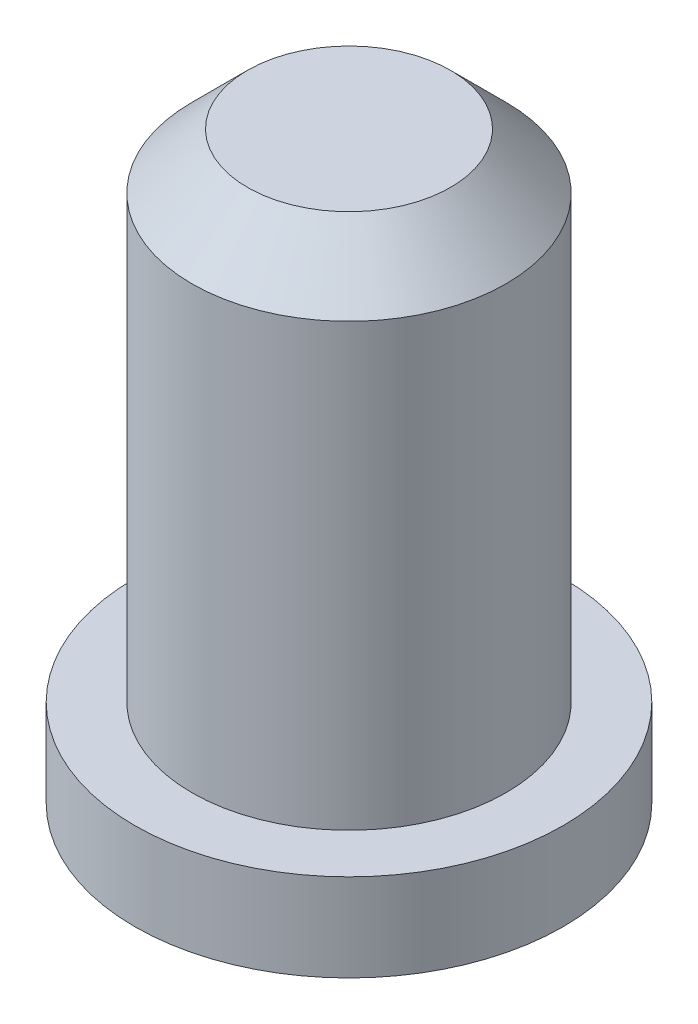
SolidWorks part; units mm, degrees
ref_plane "front" through (0, 0, 0) normal (0, 0, 1) x (1, 0, 0)
ref_plane "top" through (0, 0, 0) normal (0, 1, 0) x (1, 0, 0)
ref_plane "side" through (0, 0, 0) normal (1, 0, 0) x (0, 0, -1)
sketch "Sketch1" plane through (0, 0, 0) normal (0, 0, 1) x (1, 0, 0)
  line L0 (0, 0) -> (1.9558, 0)
  line L1 (50, 0) -> (-50, 0) construction
  line L2 (1.9558, 0) -> (1.9558, 0.8001)
  line L3 (1.9558, 0.8001) -> (1.4351, 0.8001)
  line L4 (1.4351, 0.8001) -> (1.4351, 4.826)
  line L5 (0.9271, 5.334) -> (0, 5.334)
  line L6 (0, -50) -> (0, 50) construction
  line L7 (0, 5.334) -> (0, 0)
  line L8 (0, 2.667) -> (0, -9.8345) construction
  line L9 (1.4351, 4.826) -> (0.9271, 5.334)
  point P5 (1.4351, 5.334)
  dimension "D1" = 3.9116
  dimension "D2" = 2.8702
  dimension "D3" = 0.8001
  dimension "D4" = 5.334
revolve "Revolve1" add sketch "Sketch1" angle 360 about L8
